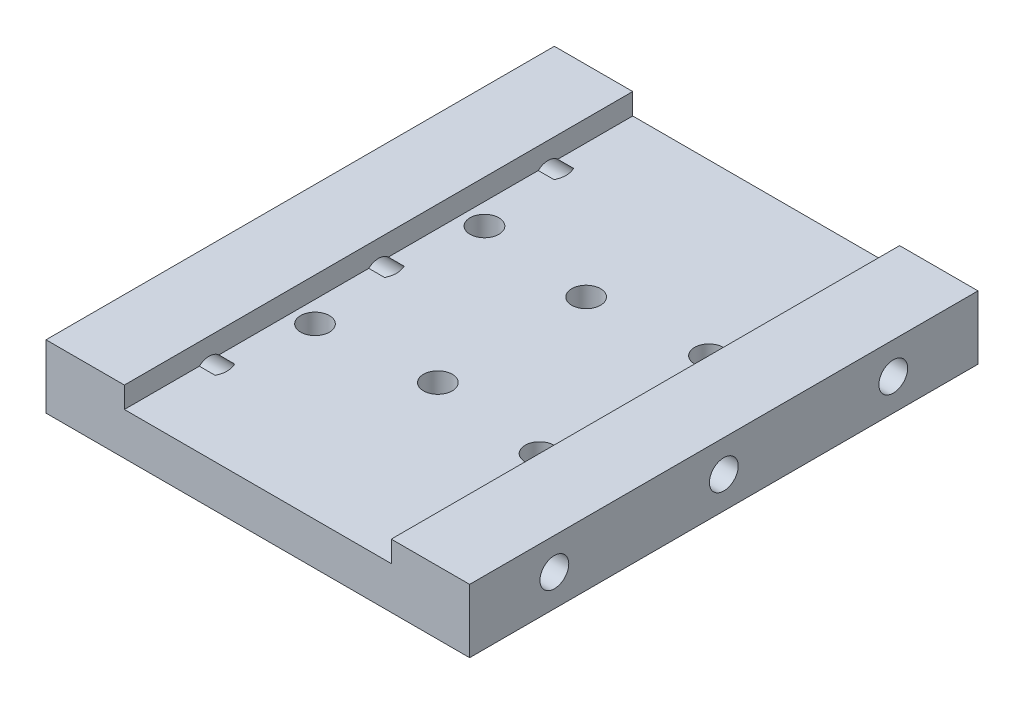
SolidWorks part; units mm, degrees
ref_plane "Face" through (0, 0, 0) normal (0, 0, 1) x (1, 0, 0)
ref_plane "Dessus" through (0, 0, 0) normal (0, 1, 0) x (1, 0, 0)
ref_plane "Droite" through (0, 0, 0) normal (1, 0, 0) x (0, 0, -1)
sketch "Esquisse1" plane through (0, 0, 0) normal (0, 0, 1) x (1, 0, 0)
  line L0 (31.5, 15) -> (50, 15)
  line L1 (-50, 15) -> (-31.5, 15)
  line L2 (-50, 15) -> (-50, 0)
  line L3 (-50, 0) -> (50, 0)
  line L4 (50, 15) -> (50, 0)
  line L6 (-31.5, 15) -> (-31.5, 10)
  line L7 (-31.5, 10) -> (31.5, 10)
  line L8 (31.5, 15) -> (31.5, 10)
  dimension "D1" = 100
  dimension "D2" = 63
  dimension "D3" = 15
  dimension "D4" = 31.5
  dimension "D5" = 5
extrude "Extrusion1" add sketch "Esquisse1" along normal mid plane 120
hole_wizard "Trou taraudé M8x1.251" positions "Esquisse3" profile "Esquisse2" tap size "M8x1.25" standard "Ansi Métrique"
sketch "Esquisse3" plane through (50, 0, 0) normal (1, 0, 0) x (0, 0, -1)
  line L0 (-60, 0) -> (60, 0) construction
  point P0 (0, 7.5)
  point P1 (-40, 7.5)
  point P2 (40, 7.5)
  dimension "D1" = 7.5
  dimension "D2" = 40
  dimension "D3" = 40
sketch "Esquisse2" plane through (50, 7.5, 0) normal (0, 1, 0) x (0, 0, -1)
  line L0 (0, 0) -> (0, 24.2929)
  line L1 (0, 24.2929) -> (3.4, 22.25)
  line L2 (3.4, 22.25) -> (3.4, 0)
  line L5 (3.4, 0) -> (0, 0)
  line L10 (0, 24.2929) -> (-3.4, 22.25) construction
  line L11 (0, -6.35) -> (0, 107.95) construction
  dimension "Diamètre du trou pour taraudage" = 6.8
  dimension "Profondeur du trou pour taraudage" = 22.25
  dimension "Angle de pointe" = 118
mirror "Symétrie1" about plane through (0, 0, 0) normal (1, 0, 0)
hole_wizard "Trou taraudé M8x1.252" positions "Esquisse5" profile "Esquisse4" tap size "M8x1.25" standard "Ansi Métrique"
sketch "Esquisse5" plane through (0, 0, 0) normal (0, -1, 0) x (1, 0, 0)
  point P0 (-26.5, 20)
  point P1 (-26.5, -20)
  point P3 (0, -17.5)
  point P5 (0, 17.5)
  point P7 (26.5, 20)
  point P9 (26.5, -20)
sketch "Esquisse4" plane through (-26.5, 0, 20) normal (1, 0, 0) x (0, 0, -1)
  line L0 (0, 0) -> (0, 15)
  line L1 (0, 15) -> (3.4, 15)
  line L2 (3.4, 15) -> (3.4, 0)
  line L5 (3.4, 0) -> (0, 0)
  line L11 (0, -6.35) -> (0, 107.95) construction
  dimension "Diamètre du trou pour taraudage jusqu'au prochain" = 6.8
  dimension "Profondeur du trou pour taraudage jusqu'au prochain" = 15
